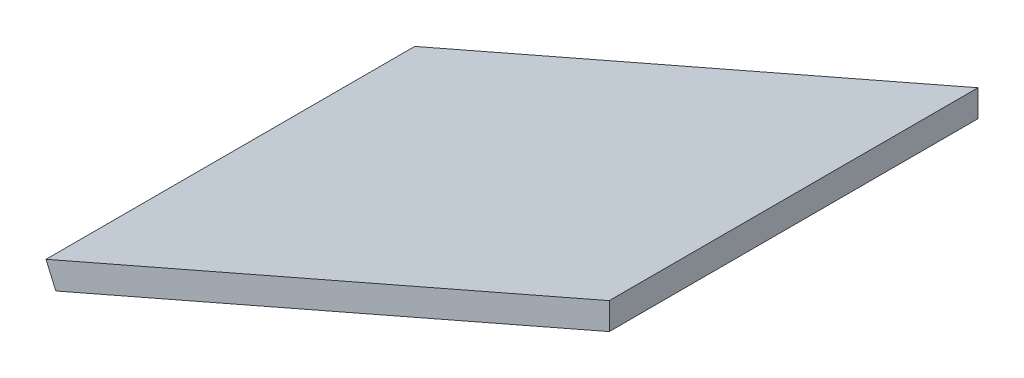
SolidWorks part; units mm, degrees
ref_plane "Plano frontal" through (0, 0, 0) normal (0, 0, 1) x (1, 0, 0)
ref_plane "Plano superior" through (0, 0, 0) normal (0, 1, 0) x (1, 0, 0)
ref_plane "Plano direito" through (0, 0, 0) normal (1, 0, 0) x (0, 0, -1)
sketch "Esboço1" plane through (0, 0, 0) normal (0, 0, 1) x (1, 0, 0)
  line L0 (22.1129, 9.6509) -> (-22.9129, -10)
  line L1 (22.1129, 11.833) -> (-23.7129, -8.167)
  line L2 (-22.9129, -10) -> (-23.7129, -8.167)
  line L3 (22.1129, 11.833) -> (22.1129, 9.6509)
  line L5 (22.9129, 10) -> (-22.9129, -10) construction
  point P4 (0, 0)
  dimension "D1" = 2
extrude "Ressalto-extrusão1" add sketch "Esboço1" along normal blind 30
